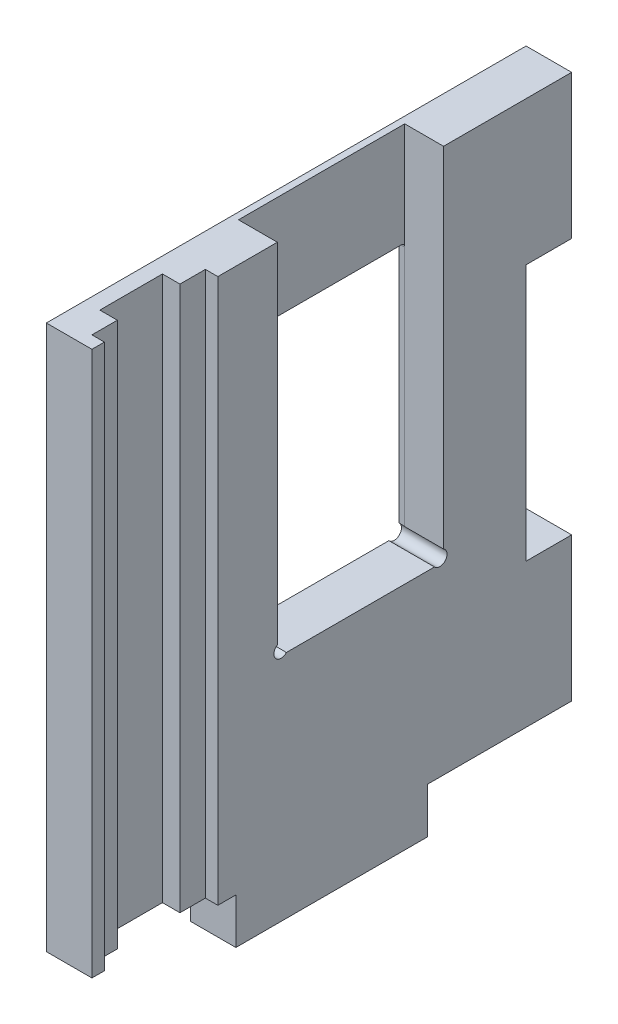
SolidWorks part; units mm, degrees
ref_plane "Plan de face" through (0, 0, 0) normal (0, 0, 1) x (1, 0, 0)
ref_plane "Plan de dessus" through (0, 0, 0) normal (0, 1, 0) x (1, 0, 0)
ref_plane "Plan de droite" through (0, 0, 0) normal (1, 0, 0) x (0, 0, -1)
sketch "Esquisse1" plane through (0, 0, 0) normal (1, 0, 0) x (0, 0, -1)
  line L1 (-100, 123) -> (100, 123)
  line L2 (-100, 123) -> (-100, -123)
  line L3 (-100, -123) -> (100, -123)
  line L4 (100, 123) -> (100, -123)
  line L5 (-100, 123) -> (100, -123) construction
  line L6 (-100, -123) -> (100, 123) construction
  point P0 (0, 0)
  dimension "D1" = 246
  dimension "D2" = 200
extrude "Boss.-Extru.1" add sketch "Esquisse1" along normal mid plane 19
sketch "Esquisse2" plane through (9.5, 0, 0) normal (1, 0, 0) x (0, 0, -1)
  line L0 (100, -123) -> (100, 123) construction
  line L1 (100, 63) -> (81, 63)
  line L2 (100, 63) -> (100, -44)
  line L3 (100, -44) -> (81, -44)
  line L4 (81, 63) -> (81, -44)
  line L5 (100, 123) -> (-100, 123) construction
  line L7 (-100, -123) -> (100, -123) construction
  dimension "D1" = 19
  dimension "D2" = 60
  dimension "D3" = 79
extrude "Enlèv. mat.-Extru.1" cut sketch "Esquisse2" against normal up to next
sketch "Esquisse3" plane through (9.5, 0, 0) normal (1, 0, 0) x (0, 0, -1)
  line L0 (81, -44) -> (100, -44) construction
  line L1 (100, -123) -> (40, -123)
  line L2 (100, -123) -> (100, -104)
  line L3 (100, -104) -> (40, -104)
  line L4 (40, -123) -> (40, -104)
  dimension "D1" = 60
extrude "Enlèv. mat.-Extru.2" cut sketch "Esquisse3" against normal up to next
mirror "Symétrie1" about plane through (0, 0, 0) normal (0, 0, 1) of "Enlèv. mat.-Extru.2"
sketch "Esquisse4" plane through (9.5, 0, 0) normal (-1, 0, 0) x (0, 0, 1)
  line L0 (-100, 123) -> (100, 123) construction
  line L1 (47.5, 123) -> (94.8, 123)
  line L2 (47.5, 123) -> (47.5, -104)
  line L3 (47.5, -104) -> (94.8, -104)
  line L4 (94.8, 123) -> (94.8, -104)
  line L5 (40, -104) -> (100, -104) construction
  line L6 (100, 123) -> (100, -104) construction
  dimension "D1" = 5.2
  dimension "D2" = 47.3
extrude "Enlèv. mat.-Extru.3" cut sketch "Esquisse4" along normal blind 5.2
sketch "Esquisse5" plane through (9.5, 0, 0) normal (-1, 0, 0) x (0, 0, 1)
  line L0 (94.8, 123) -> (47.5, 123) construction
  line L1 (84.2, 123) -> (58.1, 123)
  line L2 (84.2, 123) -> (84.2, -104)
  line L3 (84.2, -104) -> (58.1, -104)
  line L4 (58.1, 123) -> (58.1, -104)
  line L5 (47.5, -104) -> (94.8, -104) construction
  point P9 (71.15, 123)
  dimension "D1" = 26.1
extrude "Enlèv. mat.-Extru.4" cut sketch "Esquisse5" along normal blind 12.5
sketch "Esquisse6" plane through (0, 123, 0) normal (0, 1, 0) x (1, 0, 0)
  line L0 (9.5, 100) -> (9.5, -47.5) construction
  line L1 (9.5, 46.6) -> (-6.7, 46.6)
  line L2 (9.5, 46.6) -> (9.5, -22.7)
  line L3 (9.5, -22.7) -> (-6.7, -22.7)
  line L4 (-6.7, 46.6) -> (-6.7, -22.7)
  line L5 (9.5, 100) -> (-9.5, 100) construction
  line L6 (9.5, -100) -> (-9.5, -100) construction
  line L7 (-9.5, 100) -> (-9.5, -100) construction
  dimension "D1" = 53.4
  dimension "D2" = 77.3
  dimension "D3" = 2.8
extrude "Enlèv. mat.-Extru.5" cut sketch "Esquisse6" against normal blind 150
sketch "Esquisse7" plane through (-6.7, 0, 0) normal (1, 0, 0) x (0, 0, -1)
  line L0 (46.6, 123) -> (-22.7, 123) construction
  line L1 (-23.15, 80) -> (47.05, 80)
  line L2 (-23.15, 80) -> (-23.15, -27)
  line L3 (-23.15, -27) -> (47.05, -27)
  line L4 (47.05, 80) -> (47.05, -27)
  line L5 (46.6, -27) -> (-22.7, -27) construction
  point P6 (11.95, -27)
  dimension "D1" = 43
  dimension "D2" = 70.2
extrude "Enlèv. mat.-Extru.6" cut sketch "Esquisse7" against normal up to next
fillet "Congé1" radius 2 2 edges at (-8.1, 80, 23.15) (-8.1, 80, -47.05)
sketch "Esquisse8" plane through (-9.5, 0, 0) normal (-1, 0, 0) x (0, 0, 1)
  line L0 (-48.05, -25) -> (-47.05, -25) construction
  line L1 (-47.05, -27) -> (-47.05, 78) construction
  line L2 (-45.05, -28) -> (-45.05, -27) construction
  line L3 (-47.05, -27) -> (23.15, -27) construction
  circle A0 centre (-45.05, -25) radius 3
  point P10 (0, 0)
  point P11 (0, 0)
  dimension "D1" = 6
  dimension "D2" = 1
extrude "Enlèv. mat.-Extru.7" cut sketch "Esquisse8" against normal up to next
ref_plane "Plan1" through (0, 0, -11.95) normal (0, 0, 1) x (1, 0, 0)
mirror "Symétrie2" about plane through (0, 0, -11.95) normal (0, 0, 1) of "Enlèv. mat.-Extru.7"
